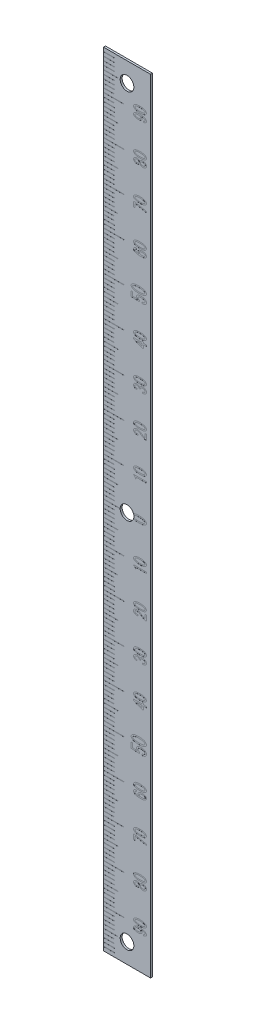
SolidWorks part; units mm, degrees
ref_plane "Front" through (0, 0, 0) normal (0, 0, 1) x (1, 0, 0)
ref_plane "Top" through (0, 0, 0) normal (0, 1, 0) x (1, 0, 0)
ref_plane "Right" through (0, 0, 0) normal (1, 0, 0) x (0, 0, -1)
sketch "Sketch1" plane through (0, 0, 0) normal (0, 0, 1) x (1, 0, 0)
  line L1 (0, 0) -> (0, 200)
  line L2 (0, 0) -> (12, 0)
  line L3 (12, 0) -> (12, 200)
  line L4 (0, 200) -> (12, 200)
  dimension "D1" = 200
  dimension "D2" = 12
extrude "Extrude1" add sketch "Sketch1" along normal blind 0.5
sketch "Sketch2" plane through (0, 0, 0.5) normal (0, 0, 1) x (1, 0, 0)
  line L0 (0, 200) -> (0, 0) construction
  line L1 (0, 0) -> (12, 0) construction
  line L2 (12, 200) -> (0, 200) construction
  circle A0 centre (6, 5) radius 1.75
  circle A1 centre (6, 195) radius 1.75
  circle A4 centre (6, 100) radius 1.75
  dimension "D1" = 6
  dimension "D2" = 6
  dimension "D3" = 5
  dimension "D4" = 5
  dimension "D5" = 3.5
  dimension "D6" = 3.5
  dimension "D8" = 2
extrude "Extrude2" cut sketch "Sketch2" against normal through all
sketch "Sketch3" plane through (0, 0, 0.5) normal (0, 0, 1) x (1, 0, 0)
  line L0 (7.5, 188.25) -> (11, 188.25) construction
  line L1 (7.5, 138.25) -> (11, 138.25) construction
  line L2 (7.5, 138.25) -> (7.5, 141.75) construction
  line L3 (7.5, 141.75) -> (11, 141.75) construction
  line L4 (11, 138.25) -> (11, 141.75) construction
  line L6 (11, 128.25) -> (11, 131.75) construction
  line L7 (11, 118.25) -> (11, 121.75) construction
  line L8 (11, 108.25) -> (11, 111.75) construction
  line L9 (11, 97.2) -> (11, 102.8) construction
  line L10 (11, 88.25) -> (11, 91.75) construction
  line L11 (11, 78.25) -> (11, 81.75) construction
  line L12 (11, 68.25) -> (11, 71.75) construction
  line L13 (11, 58.25) -> (11, 61.75) construction
  line L14 (11, 48) -> (11, 52) construction
  line L15 (11, 38.25) -> (11, 43.5) construction
  line L16 (11, 110) -> (-4.9003, 110) construction
  line L17 (11, 50) -> (-4.9003, 50) construction
  line L18 (11, 28.25) -> (11, 33.5) construction
  line L19 (11, 18.25) -> (11, 23.5) construction
  line L20 (11, 8.25) -> (11, 13.5) construction
  line L21 (11, 100) -> (-4.9003, 100) construction
  line L22 (11, 120) -> (-4.9003, 120) construction
  line L23 (11, 130) -> (-4.9003, 130) construction
  line L24 (11, 140) -> (-4.9003, 140) construction
  line L25 (7.5, 188.25) -> (7.5, 191.75) construction
  line L26 (7.5, 191.75) -> (11, 191.75) construction
  line L27 (11, 188.25) -> (11, 191.75) construction
  line L28 (11, 178.25) -> (11, 181.75) construction
  line L29 (11, 168.25) -> (11, 171.75) construction
  line L30 (11, 158.25) -> (11, 161.75) construction
  line L31 (11, 148) -> (11, 152.8) construction
  line L32 (4.5, 160) -> (-4.9003, 160) construction
  line L33 (4.5, 150) -> (-4.9003, 150) construction
  line L34 (4.5, 170) -> (-4.9003, 170) construction
  line L35 (4.5, 180) -> (-4.9003, 180) construction
  line L36 (4.5, 190) -> (-4.9003, 190) construction
  line L37 (11, 40) -> (-4.9003, 40) construction
  line L38 (11, 30) -> (-4.9003, 30) construction
  line L39 (11, 20) -> (-4.9003, 20) construction
  line L40 (11, 10) -> (-4.9003, 10) construction
  line L41 (12, 0) -> (12, 200) construction
  line L42 (11, 90) -> (-4.9003, 90) construction
  text T0 "40" font "ＭＳ ゴシック" height in points 11
  text T1 "30" font "ＭＳ ゴシック" height in points 11
  text T2 "20" font "ＭＳ ゴシック" height in points 11
  text T3 "10" font "ＭＳ ゴシック" height in points 11
  text T4 " 0 " font "ＭＳ ゴシック" height in points 13
  text T5 "10" font "ＭＳ ゴシック" height in points 11
  text T6 "20" font "ＭＳ ゴシック" height in points 11
  text T7 "30" font "ＭＳ ゴシック" height in points 11
  text T8 "40" font "ＭＳ ゴシック" height in points 11
  text T9 "50" font "ＭＳ ゴシック" height in points 13
  text T10 "60" font "ＭＳ ゴシック" height in points 11
  text T11 "70" font "ＭＳ ゴシック" height in points 11
  text T12 "80" font "ＭＳ ゴシック" height in points 11
  text T13 "90" font "ＭＳ ゴシック" height in points 11
  text T14 "50" font "ＭＳ ゴシック" height in points 13
  text T15 "60" font "ＭＳ ゴシック" height in points 11
  text T16 "70" font "ＭＳ ゴシック" height in points 11
  text T17 "80" font "ＭＳ ゴシック" height in points 11
  text T18 "90" font "ＭＳ ゴシック" height in points 11
  point P19 (11, 100)
  dimension "D1" = 3.5
  dimension "D2" = 1.75
  dimension "D4" = 3.5
  dimension "D8" = 4
  dimension "D9" = 50
  dimension "D10" = 2
  dimension "D11" = 5.6
  dimension "D12" = 1.75
  dimension "D5" = 3.5
  dimension "D13" = 1.75
  dimension "D14" = 1.75
  dimension "D15" = 1
  dimension "D16" = 1.75
  dimension "D17" = 1.75
  dimension "D18" = 1.75
  dimension "D19" = 1.75
  dimension "D20" = 1
  dimension "D21" = 1
  dimension "D23" = 1.75
  dimension "D24" = 2
  dimension "D25" = 1.75
  dimension "D26" = 1.75
  dimension "D27" = 1.75
  dimension "D28" = 1.75
  dimension "D29" = 1
  dimension "D6" = 5
  dimension "D7" = 5
  dimension "D22" = 2
extrude "Extrude3" cut sketch "Sketch3" against normal blind 0.01
sketch "Sketch4" plane through (0, 0, 0.5) normal (0, 0, 1) x (1, 0, 0)
  line L806 (5.8733, 199.8158) -> (5.8733, 186.95) construction
  line L807 (2.7465, 1.05) -> (2.7465, 0.95)
  line L808 (-0.2535, 0.95) -> (2.7465, 0.95)
  line L809 (-0.2535, 1.05) -> (2.7465, 1.05)
  line L810 (-0.2535, 1.05) -> (-0.2535, 0.95)
  line L811 (2.7465, 2.05) -> (2.7465, 1.95)
  line L812 (-0.2535, 1.95) -> (2.7465, 1.95)
  line L813 (-0.2535, 2.05) -> (2.7465, 2.05)
  line L814 (-0.2535, 2.05) -> (-0.2535, 1.95)
  line L815 (2.7465, 3.05) -> (2.7465, 2.95)
  line L816 (-0.2535, 2.95) -> (2.7465, 2.95)
  line L817 (-0.2535, 3.05) -> (2.7465, 3.05)
  line L818 (-0.2535, 3.05) -> (-0.2535, 2.95)
  line L819 (2.7465, 4.05) -> (2.7465, 3.95)
  line L820 (-0.2535, 3.95) -> (2.7465, 3.95)
  line L821 (-0.2535, 4.05) -> (2.7465, 4.05)
  line L822 (-0.2535, 4.05) -> (-0.2535, 3.95)
  line L823 (2.7465, 6.05) -> (2.7465, 5.95)
  line L824 (-0.2535, 5.95) -> (2.7465, 5.95)
  line L825 (-0.2535, 6.05) -> (2.7465, 6.05)
  line L826 (-0.2535, 6.05) -> (-0.2535, 5.95)
  line L827 (2.7465, 7.05) -> (2.7465, 6.95)
  line L828 (-0.2535, 6.95) -> (2.7465, 6.95)
  line L829 (-0.2535, 7.05) -> (2.7465, 7.05)
  line L830 (-0.2535, 7.05) -> (-0.2535, 6.95)
  line L831 (2.7465, 8.05) -> (2.7465, 7.95)
  line L832 (-0.2535, 7.95) -> (2.7465, 7.95)
  line L833 (-0.2535, 8.05) -> (2.7465, 8.05)
  line L834 (2.7465, 9.05) -> (2.7465, 8.95)
  line L835 (-0.2535, 8.95) -> (2.7465, 8.95)
  line L836 (-0.2535, 9.05) -> (-0.2535, 8.95)
  line L837 (-0.2535, 9.05) -> (2.7465, 9.05)
  line L838 (3.7465, 4.95) -> (3.7465, 5.05)
  line L839 (-0.2535, 5.05) -> (3.7465, 5.05)
  line L840 (-0.2535, 4.95) -> (-0.2535, 5.05)
  line L841 (-0.2535, 4.95) -> (3.7465, 4.95)
  line L842 (-0.2535, 8.05) -> (-0.2535, 7.95)
  line L843 (-0.2535, 9.95) -> (-0.2535, 10.05)
  line L844 (5.2465, 9.95) -> (-0.2535, 9.95)
  line L845 (5.2465, 10.05) -> (5.2465, 9.95)
  line L846 (-0.2535, 10.05) -> (5.2465, 10.05)
  line L847 (2.7465, 11.05) -> (2.7465, 10.95)
  line L848 (-0.2535, 10.95) -> (2.7465, 10.95)
  line L849 (-0.2535, 11.05) -> (2.7465, 11.05)
  line L850 (-0.2535, 11.05) -> (-0.2535, 10.95)
  line L851 (2.7465, 12.05) -> (2.7465, 11.95)
  line L852 (-0.2535, 11.95) -> (2.7465, 11.95)
  line L853 (-0.2535, 12.05) -> (2.7465, 12.05)
  line L854 (-0.2535, 12.05) -> (-0.2535, 11.95)
  line L855 (2.7465, 13.05) -> (2.7465, 12.95)
  line L856 (-0.2535, 12.95) -> (2.7465, 12.95)
  line L857 (-0.2535, 13.05) -> (2.7465, 13.05)
  line L858 (-0.2535, 13.05) -> (-0.2535, 12.95)
  line L859 (2.7465, 14.05) -> (2.7465, 13.95)
  line L860 (-0.2535, 13.95) -> (2.7465, 13.95)
  line L861 (-0.2535, 14.05) -> (2.7465, 14.05)
  line L862 (-0.2535, 14.05) -> (-0.2535, 13.95)
  line L863 (2.7465, 16.05) -> (2.7465, 15.95)
  line L864 (-0.2535, 15.95) -> (2.7465, 15.95)
  line L865 (-0.2535, 16.05) -> (2.7465, 16.05)
  line L866 (-0.2535, 16.05) -> (-0.2535, 15.95)
  line L867 (2.7465, 17.05) -> (2.7465, 16.95)
  line L868 (-0.2535, 16.95) -> (2.7465, 16.95)
  line L869 (-0.2535, 17.05) -> (2.7465, 17.05)
  line L870 (-0.2535, 17.05) -> (-0.2535, 16.95)
  line L871 (2.7465, 18.05) -> (2.7465, 17.95)
  line L872 (-0.2535, 17.95) -> (2.7465, 17.95)
  line L873 (-0.2535, 18.05) -> (2.7465, 18.05)
  line L874 (2.7465, 19.05) -> (2.7465, 18.95)
  line L875 (-0.2535, 18.95) -> (2.7465, 18.95)
  line L876 (-0.2535, 19.05) -> (-0.2535, 18.95)
  line L877 (-0.2535, 19.05) -> (2.7465, 19.05)
  line L878 (3.7465, 14.95) -> (3.7465, 15.05)
  line L879 (-0.2535, 15.05) -> (3.7465, 15.05)
  line L880 (-0.2535, 14.95) -> (-0.2535, 15.05)
  line L881 (-0.2535, 14.95) -> (3.7465, 14.95)
  line L882 (-0.2535, 18.05) -> (-0.2535, 17.95)
  line L883 (-0.2535, 19.95) -> (-0.2535, 20.05)
  line L884 (5.2465, 19.95) -> (-0.2535, 19.95)
  line L885 (5.2465, 20.05) -> (5.2465, 19.95)
  line L886 (-0.2535, 20.05) -> (5.2465, 20.05)
  line L887 (2.7465, 21.05) -> (2.7465, 20.95)
  line L888 (-0.2535, 20.95) -> (2.7465, 20.95)
  line L889 (-0.2535, 21.05) -> (2.7465, 21.05)
  line L890 (-0.2535, 21.05) -> (-0.2535, 20.95)
  line L891 (2.7465, 22.05) -> (2.7465, 21.95)
  line L892 (-0.2535, 21.95) -> (2.7465, 21.95)
  line L893 (-0.2535, 22.05) -> (2.7465, 22.05)
  line L894 (-0.2535, 22.05) -> (-0.2535, 21.95)
  line L895 (2.7465, 23.05) -> (2.7465, 22.95)
  line L896 (-0.2535, 22.95) -> (2.7465, 22.95)
  line L897 (-0.2535, 23.05) -> (2.7465, 23.05)
  line L898 (-0.2535, 23.05) -> (-0.2535, 22.95)
  line L899 (2.7465, 24.05) -> (2.7465, 23.95)
  line L900 (-0.2535, 23.95) -> (2.7465, 23.95)
  line L901 (-0.2535, 24.05) -> (2.7465, 24.05)
  line L902 (-0.2535, 24.05) -> (-0.2535, 23.95)
  line L903 (2.7465, 26.05) -> (2.7465, 25.95)
  line L904 (-0.2535, 25.95) -> (2.7465, 25.95)
  line L905 (-0.2535, 26.05) -> (2.7465, 26.05)
  line L906 (-0.2535, 26.05) -> (-0.2535, 25.95)
  line L907 (2.7465, 27.05) -> (2.7465, 26.95)
  line L908 (-0.2535, 26.95) -> (2.7465, 26.95)
  line L909 (-0.2535, 27.05) -> (2.7465, 27.05)
  line L910 (-0.2535, 27.05) -> (-0.2535, 26.95)
  line L911 (2.7465, 28.05) -> (2.7465, 27.95)
  line L912 (-0.2535, 27.95) -> (2.7465, 27.95)
  line L913 (-0.2535, 28.05) -> (2.7465, 28.05)
  line L914 (2.7465, 29.05) -> (2.7465, 28.95)
  line L915 (-0.2535, 28.95) -> (2.7465, 28.95)
  line L916 (-0.2535, 29.05) -> (-0.2535, 28.95)
  line L917 (-0.2535, 29.05) -> (2.7465, 29.05)
  line L918 (3.7465, 24.95) -> (3.7465, 25.05)
  line L919 (-0.2535, 25.05) -> (3.7465, 25.05)
  line L920 (-0.2535, 24.95) -> (-0.2535, 25.05)
  line L921 (-0.2535, 24.95) -> (3.7465, 24.95)
  line L922 (-0.2535, 28.05) -> (-0.2535, 27.95)
  line L923 (-0.2535, 29.95) -> (-0.2535, 30.05)
  line L924 (5.2465, 29.95) -> (-0.2535, 29.95)
  line L925 (5.2465, 30.05) -> (5.2465, 29.95)
  line L926 (-0.2535, 30.05) -> (5.2465, 30.05)
  line L927 (2.7465, 31.05) -> (2.7465, 30.95)
  line L928 (-0.2535, 30.95) -> (2.7465, 30.95)
  line L929 (-0.2535, 31.05) -> (2.7465, 31.05)
  line L930 (-0.2535, 31.05) -> (-0.2535, 30.95)
  line L931 (2.7465, 32.05) -> (2.7465, 31.95)
  line L932 (-0.2535, 31.95) -> (2.7465, 31.95)
  line L933 (-0.2535, 32.05) -> (2.7465, 32.05)
  line L934 (-0.2535, 32.05) -> (-0.2535, 31.95)
  line L935 (2.7465, 33.05) -> (2.7465, 32.95)
  line L936 (-0.2535, 32.95) -> (2.7465, 32.95)
  line L937 (-0.2535, 33.05) -> (2.7465, 33.05)
  line L938 (-0.2535, 33.05) -> (-0.2535, 32.95)
  line L939 (2.7465, 34.05) -> (2.7465, 33.95)
  line L940 (-0.2535, 33.95) -> (2.7465, 33.95)
  line L941 (-0.2535, 34.05) -> (2.7465, 34.05)
  line L942 (-0.2535, 34.05) -> (-0.2535, 33.95)
  line L943 (2.7465, 36.05) -> (2.7465, 35.95)
  line L944 (-0.2535, 35.95) -> (2.7465, 35.95)
  line L945 (-0.2535, 36.05) -> (2.7465, 36.05)
  line L946 (-0.2535, 36.05) -> (-0.2535, 35.95)
  line L947 (2.7465, 37.05) -> (2.7465, 36.95)
  line L948 (-0.2535, 36.95) -> (2.7465, 36.95)
  line L949 (-0.2535, 37.05) -> (2.7465, 37.05)
  line L950 (-0.2535, 37.05) -> (-0.2535, 36.95)
  line L951 (2.7465, 38.05) -> (2.7465, 37.95)
  line L952 (-0.2535, 37.95) -> (2.7465, 37.95)
  line L953 (-0.2535, 38.05) -> (2.7465, 38.05)
  line L954 (2.7465, 39.05) -> (2.7465, 38.95)
  line L955 (-0.2535, 38.95) -> (2.7465, 38.95)
  line L956 (-0.2535, 39.05) -> (-0.2535, 38.95)
  line L957 (-0.2535, 39.05) -> (2.7465, 39.05)
  line L958 (3.7465, 34.95) -> (3.7465, 35.05)
  line L959 (-0.2535, 35.05) -> (3.7465, 35.05)
  line L960 (-0.2535, 34.95) -> (-0.2535, 35.05)
  line L961 (-0.2535, 34.95) -> (3.7465, 34.95)
  line L962 (-0.2535, 38.05) -> (-0.2535, 37.95)
  line L963 (-0.2535, 39.95) -> (-0.2535, 40.05)
  line L964 (5.2465, 39.95) -> (-0.2535, 39.95)
  line L965 (5.2465, 40.05) -> (5.2465, 39.95)
  line L966 (-0.2535, 40.05) -> (5.2465, 40.05)
  line L967 (2.7465, 41.05) -> (2.7465, 40.95)
  line L968 (-0.2535, 40.95) -> (2.7465, 40.95)
  line L969 (-0.2535, 41.05) -> (2.7465, 41.05)
  line L970 (-0.2535, 41.05) -> (-0.2535, 40.95)
  line L971 (2.7465, 42.05) -> (2.7465, 41.95)
  line L972 (-0.2535, 41.95) -> (2.7465, 41.95)
  line L973 (-0.2535, 42.05) -> (2.7465, 42.05)
  line L974 (-0.2535, 42.05) -> (-0.2535, 41.95)
  line L975 (2.7465, 43.05) -> (2.7465, 42.95)
  line L976 (-0.2535, 42.95) -> (2.7465, 42.95)
  line L977 (-0.2535, 43.05) -> (2.7465, 43.05)
  line L978 (-0.2535, 43.05) -> (-0.2535, 42.95)
  line L979 (2.7465, 44.05) -> (2.7465, 43.95)
  line L980 (-0.2535, 43.95) -> (2.7465, 43.95)
  line L981 (-0.2535, 44.05) -> (2.7465, 44.05)
  line L982 (-0.2535, 44.05) -> (-0.2535, 43.95)
  line L983 (2.7465, 46.05) -> (2.7465, 45.95)
  line L984 (-0.2535, 45.95) -> (2.7465, 45.95)
  line L985 (-0.2535, 46.05) -> (2.7465, 46.05)
  line L986 (-0.2535, 46.05) -> (-0.2535, 45.95)
  line L987 (2.7465, 47.05) -> (2.7465, 46.95)
  line L988 (-0.2535, 46.95) -> (2.7465, 46.95)
  line L989 (-0.2535, 47.05) -> (2.7465, 47.05)
  line L990 (-0.2535, 47.05) -> (-0.2535, 46.95)
  line L991 (2.7465, 48.05) -> (2.7465, 47.95)
  line L992 (-0.2535, 47.95) -> (2.7465, 47.95)
  line L993 (-0.2535, 48.05) -> (2.7465, 48.05)
  line L994 (2.7465, 49.05) -> (2.7465, 48.95)
  line L995 (-0.2535, 48.95) -> (2.7465, 48.95)
  line L996 (-0.2535, 49.05) -> (-0.2535, 48.95)
  line L997 (-0.2535, 49.05) -> (2.7465, 49.05)
  line L998 (3.7465, 44.95) -> (3.7465, 45.05)
  line L999 (-0.2535, 45.05) -> (3.7465, 45.05)
  line L1000 (-0.2535, 44.95) -> (-0.2535, 45.05)
  line L1001 (-0.2535, 44.95) -> (3.7465, 44.95)
  line L1002 (-0.2535, 48.05) -> (-0.2535, 47.95)
  line L1003 (-0.2535, 49.95) -> (-0.2535, 50.05)
  line L1004 (5.2465, 49.95) -> (-0.2535, 49.95)
  line L1005 (5.2465, 50.05) -> (5.2465, 49.95)
  line L1006 (-0.2535, 50.05) -> (5.2465, 50.05)
  line L1007 (2.7465, 51.05) -> (2.7465, 50.95)
  line L1008 (-0.2535, 50.95) -> (2.7465, 50.95)
  line L1009 (-0.2535, 51.05) -> (2.7465, 51.05)
  line L1010 (-0.2535, 51.05) -> (-0.2535, 50.95)
  line L1011 (2.7465, 52.05) -> (2.7465, 51.95)
  line L1012 (-0.2535, 51.95) -> (2.7465, 51.95)
  line L1013 (-0.2535, 52.05) -> (2.7465, 52.05)
  line L1014 (-0.2535, 52.05) -> (-0.2535, 51.95)
  line L1015 (2.7465, 53.05) -> (2.7465, 52.95)
  line L1016 (-0.2535, 52.95) -> (2.7465, 52.95)
  line L1017 (-0.2535, 53.05) -> (2.7465, 53.05)
  line L1018 (-0.2535, 53.05) -> (-0.2535, 52.95)
  line L1019 (2.7465, 54.05) -> (2.7465, 53.95)
  line L1020 (-0.2535, 53.95) -> (2.7465, 53.95)
  line L1021 (-0.2535, 54.05) -> (2.7465, 54.05)
  line L1022 (-0.2535, 54.05) -> (-0.2535, 53.95)
  line L1023 (2.7465, 56.05) -> (2.7465, 55.95)
  line L1024 (-0.2535, 55.95) -> (2.7465, 55.95)
  line L1025 (-0.2535, 56.05) -> (2.7465, 56.05)
  line L1026 (-0.2535, 56.05) -> (-0.2535, 55.95)
  line L1027 (2.7465, 57.05) -> (2.7465, 56.95)
  line L1028 (-0.2535, 56.95) -> (2.7465, 56.95)
  line L1029 (-0.2535, 57.05) -> (2.7465, 57.05)
  line L1030 (-0.2535, 57.05) -> (-0.2535, 56.95)
  line L1031 (2.7465, 58.05) -> (2.7465, 57.95)
  line L1032 (-0.2535, 57.95) -> (2.7465, 57.95)
  line L1033 (-0.2535, 58.05) -> (2.7465, 58.05)
  line L1034 (2.7465, 59.05) -> (2.7465, 58.95)
  line L1035 (-0.2535, 58.95) -> (2.7465, 58.95)
  line L1036 (-0.2535, 59.05) -> (-0.2535, 58.95)
  line L1037 (-0.2535, 59.05) -> (2.7465, 59.05)
  line L1038 (3.7465, 54.95) -> (3.7465, 55.05)
  line L1039 (-0.2535, 55.05) -> (3.7465, 55.05)
  line L1040 (-0.2535, 54.95) -> (-0.2535, 55.05)
  line L1041 (-0.2535, 54.95) -> (3.7465, 54.95)
  line L1042 (-0.2535, 58.05) -> (-0.2535, 57.95)
  line L1043 (-0.2535, 59.95) -> (-0.2535, 60.05)
  line L1044 (5.2465, 59.95) -> (-0.2535, 59.95)
  line L1045 (5.2465, 60.05) -> (5.2465, 59.95)
  line L1046 (-0.2535, 60.05) -> (5.2465, 60.05)
  line L1047 (2.7465, 61.05) -> (2.7465, 60.95)
  line L1048 (-0.2535, 60.95) -> (2.7465, 60.95)
  line L1049 (-0.2535, 61.05) -> (2.7465, 61.05)
  line L1050 (-0.2535, 61.05) -> (-0.2535, 60.95)
  line L1051 (2.7465, 62.05) -> (2.7465, 61.95)
  line L1052 (-0.2535, 61.95) -> (2.7465, 61.95)
  line L1053 (-0.2535, 62.05) -> (2.7465, 62.05)
  line L1054 (-0.2535, 62.05) -> (-0.2535, 61.95)
  line L1055 (2.7465, 63.05) -> (2.7465, 62.95)
  line L1056 (-0.2535, 62.95) -> (2.7465, 62.95)
  line L1057 (-0.2535, 63.05) -> (2.7465, 63.05)
  line L1058 (-0.2535, 63.05) -> (-0.2535, 62.95)
  line L1059 (2.7465, 64.05) -> (2.7465, 63.95)
  line L1060 (-0.2535, 63.95) -> (2.7465, 63.95)
  line L1061 (-0.2535, 64.05) -> (2.7465, 64.05)
  line L1062 (-0.2535, 64.05) -> (-0.2535, 63.95)
  line L1063 (2.7465, 66.05) -> (2.7465, 65.95)
  line L1064 (-0.2535, 65.95) -> (2.7465, 65.95)
  line L1065 (-0.2535, 66.05) -> (2.7465, 66.05)
  line L1066 (-0.2535, 66.05) -> (-0.2535, 65.95)
  line L1067 (2.7465, 67.05) -> (2.7465, 66.95)
  line L1068 (-0.2535, 66.95) -> (2.7465, 66.95)
  line L1069 (-0.2535, 67.05) -> (2.7465, 67.05)
  line L1070 (-0.2535, 67.05) -> (-0.2535, 66.95)
  line L1071 (2.7465, 68.05) -> (2.7465, 67.95)
  line L1072 (-0.2535, 67.95) -> (2.7465, 67.95)
  line L1073 (-0.2535, 68.05) -> (2.7465, 68.05)
  line L1074 (2.7465, 69.05) -> (2.7465, 68.95)
  line L1075 (-0.2535, 68.95) -> (2.7465, 68.95)
  line L1076 (-0.2535, 69.05) -> (-0.2535, 68.95)
  line L1077 (-0.2535, 69.05) -> (2.7465, 69.05)
  line L1078 (3.7465, 64.95) -> (3.7465, 65.05)
  line L1079 (-0.2535, 65.05) -> (3.7465, 65.05)
  line L1080 (-0.2535, 64.95) -> (-0.2535, 65.05)
  line L1081 (-0.2535, 64.95) -> (3.7465, 64.95)
  line L1082 (-0.2535, 68.05) -> (-0.2535, 67.95)
  line L1083 (-0.2535, 69.95) -> (-0.2535, 70.05)
  line L1084 (5.2465, 69.95) -> (-0.2535, 69.95)
  line L1085 (5.2465, 70.05) -> (5.2465, 69.95)
  line L1086 (-0.2535, 70.05) -> (5.2465, 70.05)
  line L1087 (2.7465, 71.05) -> (2.7465, 70.95)
  line L1088 (-0.2535, 70.95) -> (2.7465, 70.95)
  line L1089 (-0.2535, 71.05) -> (2.7465, 71.05)
  line L1090 (-0.2535, 71.05) -> (-0.2535, 70.95)
  line L1091 (2.7465, 72.05) -> (2.7465, 71.95)
  line L1092 (-0.2535, 71.95) -> (2.7465, 71.95)
  line L1093 (-0.2535, 72.05) -> (2.7465, 72.05)
  line L1094 (-0.2535, 72.05) -> (-0.2535, 71.95)
  line L1095 (2.7465, 73.05) -> (2.7465, 72.95)
  line L1096 (-0.2535, 72.95) -> (2.7465, 72.95)
  line L1097 (-0.2535, 73.05) -> (2.7465, 73.05)
  line L1098 (-0.2535, 73.05) -> (-0.2535, 72.95)
  line L1099 (2.7465, 74.05) -> (2.7465, 73.95)
  line L1100 (-0.2535, 73.95) -> (2.7465, 73.95)
  line L1101 (-0.2535, 74.05) -> (2.7465, 74.05)
  line L1102 (-0.2535, 74.05) -> (-0.2535, 73.95)
  line L1103 (2.7465, 76.05) -> (2.7465, 75.95)
  line L1104 (-0.2535, 75.95) -> (2.7465, 75.95)
  line L1105 (-0.2535, 76.05) -> (2.7465, 76.05)
  line L1106 (-0.2535, 76.05) -> (-0.2535, 75.95)
  line L1107 (2.7465, 77.05) -> (2.7465, 76.95)
  line L1108 (-0.2535, 76.95) -> (2.7465, 76.95)
  line L1109 (-0.2535, 77.05) -> (2.7465, 77.05)
  line L1110 (-0.2535, 77.05) -> (-0.2535, 76.95)
  line L1111 (2.7465, 78.05) -> (2.7465, 77.95)
  line L1112 (-0.2535, 77.95) -> (2.7465, 77.95)
  line L1113 (-0.2535, 78.05) -> (2.7465, 78.05)
  line L1114 (2.7465, 79.05) -> (2.7465, 78.95)
  line L1115 (-0.2535, 78.95) -> (2.7465, 78.95)
  line L1116 (-0.2535, 79.05) -> (-0.2535, 78.95)
  line L1117 (-0.2535, 79.05) -> (2.7465, 79.05)
  line L1118 (3.7465, 74.95) -> (3.7465, 75.05)
  line L1119 (-0.2535, 75.05) -> (3.7465, 75.05)
  line L1120 (-0.2535, 74.95) -> (-0.2535, 75.05)
  line L1121 (-0.2535, 74.95) -> (3.7465, 74.95)
  line L1122 (-0.2535, 78.05) -> (-0.2535, 77.95)
  line L1123 (-0.2535, 79.95) -> (-0.2535, 80.05)
  line L1124 (5.2465, 79.95) -> (-0.2535, 79.95)
  line L1125 (5.2465, 80.05) -> (5.2465, 79.95)
  line L1126 (-0.2535, 80.05) -> (5.2465, 80.05)
  line L1127 (2.7465, 81.05) -> (2.7465, 80.95)
  line L1128 (-0.2535, 80.95) -> (2.7465, 80.95)
  line L1129 (-0.2535, 81.05) -> (2.7465, 81.05)
  line L1130 (-0.2535, 81.05) -> (-0.2535, 80.95)
  line L1131 (2.7465, 82.05) -> (2.7465, 81.95)
  line L1132 (-0.2535, 81.95) -> (2.7465, 81.95)
  line L1133 (-0.2535, 82.05) -> (2.7465, 82.05)
  line L1134 (-0.2535, 82.05) -> (-0.2535, 81.95)
  line L1135 (2.7465, 83.05) -> (2.7465, 82.95)
  line L1136 (-0.2535, 82.95) -> (2.7465, 82.95)
  line L1137 (-0.2535, 83.05) -> (2.7465, 83.05)
  line L1138 (-0.2535, 83.05) -> (-0.2535, 82.95)
  line L1139 (2.7465, 84.05) -> (2.7465, 83.95)
  line L1140 (-0.2535, 83.95) -> (2.7465, 83.95)
  line L1141 (-0.2535, 84.05) -> (2.7465, 84.05)
  line L1142 (-0.2535, 84.05) -> (-0.2535, 83.95)
  line L1143 (2.7465, 86.05) -> (2.7465, 85.95)
  line L1144 (-0.2535, 85.95) -> (2.7465, 85.95)
  line L1145 (-0.2535, 86.05) -> (2.7465, 86.05)
  line L1146 (-0.2535, 86.05) -> (-0.2535, 85.95)
  line L1147 (2.7465, 87.05) -> (2.7465, 86.95)
  line L1148 (-0.2535, 86.95) -> (2.7465, 86.95)
  line L1149 (-0.2535, 87.05) -> (2.7465, 87.05)
  line L1150 (-0.2535, 87.05) -> (-0.2535, 86.95)
  line L1151 (2.7465, 88.05) -> (2.7465, 87.95)
  line L1152 (-0.2535, 87.95) -> (2.7465, 87.95)
  line L1153 (-0.2535, 88.05) -> (2.7465, 88.05)
  line L1154 (2.7465, 89.05) -> (2.7465, 88.95)
  line L1155 (-0.2535, 88.95) -> (2.7465, 88.95)
  line L1156 (-0.2535, 89.05) -> (-0.2535, 88.95)
  line L1157 (-0.2535, 89.05) -> (2.7465, 89.05)
  line L1158 (3.7465, 84.95) -> (3.7465, 85.05)
  line L1159 (-0.2535, 85.05) -> (3.7465, 85.05)
  line L1160 (-0.2535, 84.95) -> (-0.2535, 85.05)
  line L1161 (-0.2535, 84.95) -> (3.7465, 84.95)
  line L1162 (-0.2535, 88.05) -> (-0.2535, 87.95)
  line L1163 (-0.2535, 89.95) -> (-0.2535, 90.05)
  line L1164 (5.2465, 89.95) -> (-0.2535, 89.95)
  line L1165 (5.2465, 90.05) -> (5.2465, 89.95)
  line L1166 (-0.2535, 90.05) -> (5.2465, 90.05)
  line L1167 (2.7465, 91.05) -> (2.7465, 90.95)
  line L1168 (-0.2535, 90.95) -> (2.7465, 90.95)
  line L1169 (-0.2535, 91.05) -> (2.7465, 91.05)
  line L1170 (-0.2535, 91.05) -> (-0.2535, 90.95)
  line L1171 (2.7465, 92.05) -> (2.7465, 91.95)
  line L1172 (-0.2535, 91.95) -> (2.7465, 91.95)
  line L1173 (-0.2535, 92.05) -> (2.7465, 92.05)
  line L1174 (-0.2535, 92.05) -> (-0.2535, 91.95)
  line L1175 (2.7465, 93.05) -> (2.7465, 92.95)
  line L1176 (-0.2535, 92.95) -> (2.7465, 92.95)
  line L1177 (-0.2535, 93.05) -> (2.7465, 93.05)
  line L1178 (-0.2535, 93.05) -> (-0.2535, 92.95)
  line L1179 (2.7465, 94.05) -> (2.7465, 93.95)
  line L1180 (-0.2535, 93.95) -> (2.7465, 93.95)
  line L1181 (-0.2535, 94.05) -> (2.7465, 94.05)
  line L1182 (-0.2535, 94.05) -> (-0.2535, 93.95)
  line L1183 (2.7465, 96.05) -> (2.7465, 95.95)
  line L1184 (-0.2535, 95.95) -> (2.7465, 95.95)
  line L1185 (-0.2535, 96.05) -> (2.7465, 96.05)
  line L1186 (-0.2535, 96.05) -> (-0.2535, 95.95)
  line L1187 (2.7465, 97.05) -> (2.7465, 96.95)
  line L1188 (-0.2535, 96.95) -> (2.7465, 96.95)
  line L1189 (-0.2535, 97.05) -> (2.7465, 97.05)
  line L1190 (-0.2535, 97.05) -> (-0.2535, 96.95)
  line L1191 (2.7465, 98.05) -> (2.7465, 97.95)
  line L1192 (-0.2535, 97.95) -> (2.7465, 97.95)
  line L1193 (-0.2535, 98.05) -> (2.7465, 98.05)
  line L1194 (2.7465, 99.05) -> (2.7465, 98.95)
  line L1195 (-0.2535, 98.95) -> (2.7465, 98.95)
  line L1196 (-0.2535, 99.05) -> (-0.2535, 98.95)
  line L1197 (-0.2535, 99.05) -> (2.7465, 99.05)
  line L1198 (3.7465, 94.95) -> (3.7465, 95.05)
  line L1199 (-0.2535, 95.05) -> (3.7465, 95.05)
  line L1200 (-0.2535, 94.95) -> (-0.2535, 95.05)
  line L1201 (-0.2535, 94.95) -> (3.7465, 94.95)
  line L1202 (-0.2535, 98.05) -> (-0.2535, 97.95)
  line L1203 (-0.2535, 99.95) -> (-0.2535, 100.05)
  line L1204 (5.2465, 99.95) -> (-0.2535, 99.95)
  line L1205 (5.2465, 100.05) -> (5.2465, 99.95)
  line L1206 (-0.2535, 100.05) -> (5.2465, 100.05)
  line L1207 (2.7465, 101.05) -> (2.7465, 100.95)
  line L1208 (-0.2535, 100.95) -> (2.7465, 100.95)
  line L1209 (-0.2535, 101.05) -> (2.7465, 101.05)
  line L1210 (-0.2535, 101.05) -> (-0.2535, 100.95)
  line L1211 (2.7465, 102.05) -> (2.7465, 101.95)
  line L1212 (-0.2535, 101.95) -> (2.7465, 101.95)
  line L1213 (-0.2535, 102.05) -> (2.7465, 102.05)
  line L1214 (-0.2535, 102.05) -> (-0.2535, 101.95)
  line L1215 (2.7465, 103.05) -> (2.7465, 102.95)
  line L1216 (-0.2535, 102.95) -> (2.7465, 102.95)
  line L1217 (-0.2535, 103.05) -> (2.7465, 103.05)
  line L1218 (-0.2535, 103.05) -> (-0.2535, 102.95)
  line L1219 (2.7465, 104.05) -> (2.7465, 103.95)
  line L1220 (-0.2535, 103.95) -> (2.7465, 103.95)
  line L1221 (-0.2535, 104.05) -> (2.7465, 104.05)
  line L1222 (-0.2535, 104.05) -> (-0.2535, 103.95)
  line L1223 (2.7465, 106.05) -> (2.7465, 105.95)
  line L1224 (-0.2535, 105.95) -> (2.7465, 105.95)
  line L1225 (-0.2535, 106.05) -> (2.7465, 106.05)
  line L1226 (-0.2535, 106.05) -> (-0.2535, 105.95)
  line L1227 (2.7465, 107.05) -> (2.7465, 106.95)
  line L1228 (-0.2535, 106.95) -> (2.7465, 106.95)
  line L1229 (-0.2535, 107.05) -> (2.7465, 107.05)
  line L1230 (-0.2535, 107.05) -> (-0.2535, 106.95)
  line L1231 (2.7465, 108.05) -> (2.7465, 107.95)
  line L1232 (-0.2535, 107.95) -> (2.7465, 107.95)
  line L1233 (-0.2535, 108.05) -> (2.7465, 108.05)
  line L1234 (2.7465, 109.05) -> (2.7465, 108.95)
  line L1235 (-0.2535, 108.95) -> (2.7465, 108.95)
  line L1236 (-0.2535, 109.05) -> (-0.2535, 108.95)
  line L1237 (-0.2535, 109.05) -> (2.7465, 109.05)
  line L1238 (3.7465, 104.95) -> (3.7465, 105.05)
  line L1239 (-0.2535, 105.05) -> (3.7465, 105.05)
  line L1240 (-0.2535, 104.95) -> (-0.2535, 105.05)
  line L1241 (-0.2535, 104.95) -> (3.7465, 104.95)
  line L1242 (-0.2535, 108.05) -> (-0.2535, 107.95)
  line L1243 (-0.2535, 109.95) -> (-0.2535, 110.05)
  line L1244 (5.2465, 109.95) -> (-0.2535, 109.95)
  line L1245 (5.2465, 110.05) -> (5.2465, 109.95)
  line L1246 (-0.2535, 110.05) -> (5.2465, 110.05)
  line L1247 (2.7465, 111.05) -> (2.7465, 110.95)
  line L1248 (-0.2535, 110.95) -> (2.7465, 110.95)
  line L1249 (-0.2535, 111.05) -> (2.7465, 111.05)
  line L1250 (-0.2535, 111.05) -> (-0.2535, 110.95)
  line L1251 (2.7465, 112.05) -> (2.7465, 111.95)
  line L1252 (-0.2535, 111.95) -> (2.7465, 111.95)
  line L1253 (-0.2535, 112.05) -> (2.7465, 112.05)
  line L1254 (-0.2535, 112.05) -> (-0.2535, 111.95)
  line L1255 (2.7465, 113.05) -> (2.7465, 112.95)
  line L1256 (-0.2535, 112.95) -> (2.7465, 112.95)
  line L1257 (-0.2535, 113.05) -> (2.7465, 113.05)
  line L1258 (-0.2535, 113.05) -> (-0.2535, 112.95)
  line L1259 (2.7465, 114.05) -> (2.7465, 113.95)
  line L1260 (-0.2535, 113.95) -> (2.7465, 113.95)
  line L1261 (-0.2535, 114.05) -> (2.7465, 114.05)
  line L1262 (-0.2535, 114.05) -> (-0.2535, 113.95)
  line L1263 (2.7465, 116.05) -> (2.7465, 115.95)
  line L1264 (-0.2535, 115.95) -> (2.7465, 115.95)
  line L1265 (-0.2535, 116.05) -> (2.7465, 116.05)
  line L1266 (-0.2535, 116.05) -> (-0.2535, 115.95)
  line L1267 (2.7465, 117.05) -> (2.7465, 116.95)
  line L1268 (-0.2535, 116.95) -> (2.7465, 116.95)
  line L1269 (-0.2535, 117.05) -> (2.7465, 117.05)
  line L1270 (-0.2535, 117.05) -> (-0.2535, 116.95)
  line L1271 (2.7465, 118.05) -> (2.7465, 117.95)
  line L1272 (-0.2535, 117.95) -> (2.7465, 117.95)
  line L1273 (-0.2535, 118.05) -> (2.7465, 118.05)
  line L1274 (2.7465, 119.05) -> (2.7465, 118.95)
  line L1275 (-0.2535, 118.95) -> (2.7465, 118.95)
  line L1276 (-0.2535, 119.05) -> (-0.2535, 118.95)
  line L1277 (-0.2535, 119.05) -> (2.7465, 119.05)
  line L1278 (3.7465, 114.95) -> (3.7465, 115.05)
  line L1279 (-0.2535, 115.05) -> (3.7465, 115.05)
  line L1280 (-0.2535, 114.95) -> (-0.2535, 115.05)
  line L1281 (-0.2535, 114.95) -> (3.7465, 114.95)
  line L1282 (-0.2535, 118.05) -> (-0.2535, 117.95)
  line L1283 (-0.2535, 119.95) -> (-0.2535, 120.05)
  line L1284 (5.2465, 119.95) -> (-0.2535, 119.95)
  line L1285 (5.2465, 120.05) -> (5.2465, 119.95)
  line L1286 (-0.2535, 120.05) -> (5.2465, 120.05)
  line L1287 (2.7465, 121.05) -> (2.7465, 120.95)
  line L1288 (-0.2535, 120.95) -> (2.7465, 120.95)
  line L1289 (-0.2535, 121.05) -> (2.7465, 121.05)
  line L1290 (-0.2535, 121.05) -> (-0.2535, 120.95)
  line L1291 (2.7465, 122.05) -> (2.7465, 121.95)
  line L1292 (-0.2535, 121.95) -> (2.7465, 121.95)
  line L1293 (-0.2535, 122.05) -> (2.7465, 122.05)
  line L1294 (-0.2535, 122.05) -> (-0.2535, 121.95)
  line L1295 (2.7465, 123.05) -> (2.7465, 122.95)
  line L1296 (-0.2535, 122.95) -> (2.7465, 122.95)
  line L1297 (-0.2535, 123.05) -> (2.7465, 123.05)
  line L1298 (-0.2535, 123.05) -> (-0.2535, 122.95)
  line L1299 (2.7465, 124.05) -> (2.7465, 123.95)
  line L1300 (-0.2535, 123.95) -> (2.7465, 123.95)
  line L1301 (-0.2535, 124.05) -> (2.7465, 124.05)
  line L1302 (-0.2535, 124.05) -> (-0.2535, 123.95)
  line L1303 (2.7465, 126.05) -> (2.7465, 125.95)
  line L1304 (-0.2535, 125.95) -> (2.7465, 125.95)
  line L1305 (-0.2535, 126.05) -> (2.7465, 126.05)
  line L1306 (-0.2535, 126.05) -> (-0.2535, 125.95)
  line L1307 (2.7465, 127.05) -> (2.7465, 126.95)
  line L1308 (-0.2535, 126.95) -> (2.7465, 126.95)
  line L1309 (-0.2535, 127.05) -> (2.7465, 127.05)
  line L1310 (-0.2535, 127.05) -> (-0.2535, 126.95)
  line L1311 (2.7465, 128.05) -> (2.7465, 127.95)
  line L1312 (-0.2535, 127.95) -> (2.7465, 127.95)
  line L1313 (-0.2535, 128.05) -> (2.7465, 128.05)
  line L1314 (2.7465, 129.05) -> (2.7465, 128.95)
  line L1315 (-0.2535, 128.95) -> (2.7465, 128.95)
  line L1316 (-0.2535, 129.05) -> (-0.2535, 128.95)
  line L1317 (-0.2535, 129.05) -> (2.7465, 129.05)
  line L1318 (3.7465, 124.95) -> (3.7465, 125.05)
  line L1319 (-0.2535, 125.05) -> (3.7465, 125.05)
  line L1320 (-0.2535, 124.95) -> (-0.2535, 125.05)
  line L1321 (-0.2535, 124.95) -> (3.7465, 124.95)
  line L1322 (-0.2535, 128.05) -> (-0.2535, 127.95)
  line L1323 (-0.2535, 129.95) -> (-0.2535, 130.05)
  line L1324 (5.2465, 129.95) -> (-0.2535, 129.95)
  line L1325 (5.2465, 130.05) -> (5.2465, 129.95)
  line L1326 (-0.2535, 130.05) -> (5.2465, 130.05)
  line L1327 (2.7465, 131.05) -> (2.7465, 130.95)
  line L1328 (-0.2535, 130.95) -> (2.7465, 130.95)
  line L1329 (-0.2535, 131.05) -> (2.7465, 131.05)
  line L1330 (-0.2535, 131.05) -> (-0.2535, 130.95)
  line L1331 (2.7465, 132.05) -> (2.7465, 131.95)
  line L1332 (-0.2535, 131.95) -> (2.7465, 131.95)
  line L1333 (-0.2535, 132.05) -> (2.7465, 132.05)
  line L1334 (-0.2535, 132.05) -> (-0.2535, 131.95)
  line L1335 (2.7465, 133.05) -> (2.7465, 132.95)
  line L1336 (-0.2535, 132.95) -> (2.7465, 132.95)
  line L1337 (-0.2535, 133.05) -> (2.7465, 133.05)
  line L1338 (-0.2535, 133.05) -> (-0.2535, 132.95)
  line L1339 (2.7465, 134.05) -> (2.7465, 133.95)
  line L1340 (-0.2535, 133.95) -> (2.7465, 133.95)
  line L1341 (-0.2535, 134.05) -> (2.7465, 134.05)
  line L1342 (-0.2535, 134.05) -> (-0.2535, 133.95)
  line L1343 (2.7465, 136.05) -> (2.7465, 135.95)
  line L1344 (-0.2535, 135.95) -> (2.7465, 135.95)
  line L1345 (-0.2535, 136.05) -> (2.7465, 136.05)
  line L1346 (-0.2535, 136.05) -> (-0.2535, 135.95)
  line L1347 (2.7465, 137.05) -> (2.7465, 136.95)
  line L1348 (-0.2535, 136.95) -> (2.7465, 136.95)
  line L1349 (-0.2535, 137.05) -> (2.7465, 137.05)
  line L1350 (-0.2535, 137.05) -> (-0.2535, 136.95)
  line L1351 (2.7465, 138.05) -> (2.7465, 137.95)
  line L1352 (-0.2535, 137.95) -> (2.7465, 137.95)
  line L1353 (-0.2535, 138.05) -> (2.7465, 138.05)
  line L1354 (2.7465, 139.05) -> (2.7465, 138.95)
  line L1355 (-0.2535, 138.95) -> (2.7465, 138.95)
  line L1356 (-0.2535, 139.05) -> (-0.2535, 138.95)
  line L1357 (-0.2535, 139.05) -> (2.7465, 139.05)
  line L1358 (3.7465, 134.95) -> (3.7465, 135.05)
  line L1359 (-0.2535, 135.05) -> (3.7465, 135.05)
  line L1360 (-0.2535, 134.95) -> (-0.2535, 135.05)
  line L1361 (-0.2535, 134.95) -> (3.7465, 134.95)
  line L1362 (-0.2535, 138.05) -> (-0.2535, 137.95)
  line L1363 (-0.2535, 139.95) -> (-0.2535, 140.05)
  line L1364 (5.2465, 139.95) -> (-0.2535, 139.95)
  line L1365 (5.2465, 140.05) -> (5.2465, 139.95)
  line L1366 (-0.2535, 140.05) -> (5.2465, 140.05)
  line L1367 (2.7465, 141.05) -> (2.7465, 140.95)
  line L1368 (-0.2535, 140.95) -> (2.7465, 140.95)
  line L1369 (-0.2535, 141.05) -> (2.7465, 141.05)
  line L1370 (-0.2535, 141.05) -> (-0.2535, 140.95)
  line L1371 (2.7465, 142.05) -> (2.7465, 141.95)
  line L1372 (-0.2535, 141.95) -> (2.7465, 141.95)
  line L1373 (-0.2535, 142.05) -> (2.7465, 142.05)
  line L1374 (-0.2535, 142.05) -> (-0.2535, 141.95)
  line L1375 (2.7465, 143.05) -> (2.7465, 142.95)
  line L1376 (-0.2535, 142.95) -> (2.7465, 142.95)
  line L1377 (-0.2535, 143.05) -> (2.7465, 143.05)
  line L1378 (-0.2535, 143.05) -> (-0.2535, 142.95)
  line L1379 (2.7465, 144.05) -> (2.7465, 143.95)
  line L1380 (-0.2535, 143.95) -> (2.7465, 143.95)
  line L1381 (-0.2535, 144.05) -> (2.7465, 144.05)
  line L1382 (-0.2535, 144.05) -> (-0.2535, 143.95)
  line L1383 (2.7465, 146.05) -> (2.7465, 145.95)
  line L1384 (-0.2535, 145.95) -> (2.7465, 145.95)
  line L1385 (-0.2535, 146.05) -> (2.7465, 146.05)
  line L1386 (-0.2535, 146.05) -> (-0.2535, 145.95)
  line L1387 (2.7465, 147.05) -> (2.7465, 146.95)
  line L1388 (-0.2535, 146.95) -> (2.7465, 146.95)
  line L1389 (-0.2535, 147.05) -> (2.7465, 147.05)
  line L1390 (-0.2535, 147.05) -> (-0.2535, 146.95)
  line L1391 (2.7465, 148.05) -> (2.7465, 147.95)
  line L1392 (-0.2535, 147.95) -> (2.7465, 147.95)
  line L1393 (-0.2535, 148.05) -> (2.7465, 148.05)
  line L1394 (2.7465, 149.05) -> (2.7465, 148.95)
  line L1395 (-0.2535, 148.95) -> (2.7465, 148.95)
  line L1396 (-0.2535, 149.05) -> (-0.2535, 148.95)
  line L1397 (-0.2535, 149.05) -> (2.7465, 149.05)
  line L1398 (3.7465, 144.95) -> (3.7465, 145.05)
  line L1399 (-0.2535, 145.05) -> (3.7465, 145.05)
  line L1400 (-0.2535, 144.95) -> (-0.2535, 145.05)
  line L1401 (-0.2535, 144.95) -> (3.7465, 144.95)
  line L1402 (-0.2535, 148.05) -> (-0.2535, 147.95)
  line L1403 (2.7465, 151.05) -> (2.7465, 150.95)
  line L1404 (-0.2535, 150.95) -> (2.7465, 150.95)
  line L1405 (-0.2535, 151.05) -> (2.7465, 151.05)
  line L1406 (-0.2535, 151.05) -> (-0.2535, 150.95)
  line L1407 (2.7465, 152.05) -> (2.7465, 151.95)
  line L1408 (-0.2535, 151.95) -> (2.7465, 151.95)
  line L1409 (-0.2535, 152.05) -> (2.7465, 152.05)
  line L1410 (-0.2535, 152.05) -> (-0.2535, 151.95)
  line L1411 (2.7465, 153.05) -> (2.7465, 152.95)
  line L1412 (-0.2535, 152.95) -> (2.7465, 152.95)
  line L1413 (-0.2535, 153.05) -> (2.7465, 153.05)
  line L1414 (-0.2535, 153.05) -> (-0.2535, 152.95)
  line L1415 (2.7465, 154.05) -> (2.7465, 153.95)
  line L1416 (-0.2535, 153.95) -> (2.7465, 153.95)
  line L1417 (-0.2535, 154.05) -> (2.7465, 154.05)
  line L1418 (-0.2535, 154.05) -> (-0.2535, 153.95)
  line L1419 (2.7465, 156.05) -> (2.7465, 155.95)
  line L1420 (-0.2535, 155.95) -> (2.7465, 155.95)
  line L1421 (-0.2535, 156.05) -> (2.7465, 156.05)
  line L1422 (-0.2535, 156.05) -> (-0.2535, 155.95)
  line L1423 (2.7465, 157.05) -> (2.7465, 156.95)
  line L1424 (-0.2535, 156.95) -> (2.7465, 156.95)
  line L1425 (-0.2535, 157.05) -> (2.7465, 157.05)
  line L1426 (-0.2535, 157.05) -> (-0.2535, 156.95)
  line L1427 (2.7465, 158.05) -> (2.7465, 157.95)
  line L1428 (-0.2535, 157.95) -> (2.7465, 157.95)
  line L1429 (-0.2535, 158.05) -> (2.7465, 158.05)
  line L1430 (2.7465, 159.05) -> (2.7465, 158.95)
  line L1431 (-0.2535, 158.95) -> (2.7465, 158.95)
  line L1432 (-0.2535, 159.05) -> (-0.2535, 158.95)
  line L1433 (-0.2535, 159.05) -> (2.7465, 159.05)
  line L1434 (3.7465, 154.95) -> (3.7465, 155.05)
  line L1435 (-0.2535, 155.05) -> (3.7465, 155.05)
  line L1436 (-0.2535, 154.95) -> (-0.2535, 155.05)
  line L1437 (-0.2535, 154.95) -> (3.7465, 154.95)
  line L1438 (-0.2535, 158.05) -> (-0.2535, 157.95)
  line L1439 (-0.2535, 149.95) -> (-0.2535, 150.05)
  line L1440 (5.2465, 149.95) -> (-0.2535, 149.95)
  line L1441 (5.2465, 150.05) -> (5.2465, 149.95)
  line L1442 (-0.2535, 150.05) -> (5.2465, 150.05)
  line L1443 (2.7465, 161.05) -> (2.7465, 160.95)
  line L1444 (-0.2535, 160.95) -> (2.7465, 160.95)
  line L1445 (-0.2535, 161.05) -> (2.7465, 161.05)
  line L1446 (-0.2535, 161.05) -> (-0.2535, 160.95)
  line L1447 (2.7465, 162.05) -> (2.7465, 161.95)
  line L1448 (-0.2535, 161.95) -> (2.7465, 161.95)
  line L1449 (-0.2535, 162.05) -> (2.7465, 162.05)
  line L1450 (-0.2535, 162.05) -> (-0.2535, 161.95)
  line L1451 (2.7465, 163.05) -> (2.7465, 162.95)
  line L1452 (-0.2535, 162.95) -> (2.7465, 162.95)
  line L1453 (-0.2535, 163.05) -> (2.7465, 163.05)
  line L1454 (-0.2535, 163.05) -> (-0.2535, 162.95)
  line L1455 (2.7465, 164.05) -> (2.7465, 163.95)
  line L1456 (-0.2535, 163.95) -> (2.7465, 163.95)
  line L1457 (-0.2535, 164.05) -> (2.7465, 164.05)
  line L1458 (-0.2535, 164.05) -> (-0.2535, 163.95)
  line L1459 (2.7465, 166.05) -> (2.7465, 165.95)
  line L1460 (-0.2535, 165.95) -> (2.7465, 165.95)
  line L1461 (-0.2535, 166.05) -> (2.7465, 166.05)
  line L1462 (-0.2535, 166.05) -> (-0.2535, 165.95)
  line L1463 (2.7465, 167.05) -> (2.7465, 166.95)
  line L1464 (-0.2535, 166.95) -> (2.7465, 166.95)
  line L1465 (-0.2535, 167.05) -> (2.7465, 167.05)
  line L1466 (-0.2535, 167.05) -> (-0.2535, 166.95)
  line L1467 (2.7465, 168.05) -> (2.7465, 167.95)
  line L1468 (-0.2535, 167.95) -> (2.7465, 167.95)
  line L1469 (-0.2535, 168.05) -> (2.7465, 168.05)
  line L1470 (2.7465, 169.05) -> (2.7465, 168.95)
  line L1471 (-0.2535, 168.95) -> (2.7465, 168.95)
  line L1472 (-0.2535, 169.05) -> (-0.2535, 168.95)
  line L1473 (-0.2535, 169.05) -> (2.7465, 169.05)
  line L1474 (3.7465, 164.95) -> (3.7465, 165.05)
  line L1475 (-0.2535, 165.05) -> (3.7465, 165.05)
  line L1476 (-0.2535, 164.95) -> (-0.2535, 165.05)
  line L1477 (-0.2535, 164.95) -> (3.7465, 164.95)
  line L1478 (-0.2535, 168.05) -> (-0.2535, 167.95)
  line L1479 (-0.2535, 159.95) -> (-0.2535, 160.05)
  line L1480 (5.2465, 159.95) -> (-0.2535, 159.95)
  line L1481 (5.2465, 160.05) -> (5.2465, 159.95)
  line L1482 (-0.2535, 160.05) -> (5.2465, 160.05)
  line L1483 (2.7465, 171.05) -> (2.7465, 170.95)
  line L1484 (-0.2535, 170.95) -> (2.7465, 170.95)
  line L1485 (-0.2535, 171.05) -> (2.7465, 171.05)
  line L1486 (-0.2535, 171.05) -> (-0.2535, 170.95)
  line L1487 (2.7465, 172.05) -> (2.7465, 171.95)
  line L1488 (-0.2535, 171.95) -> (2.7465, 171.95)
  line L1489 (-0.2535, 172.05) -> (2.7465, 172.05)
  line L1490 (-0.2535, 172.05) -> (-0.2535, 171.95)
  line L1491 (2.7465, 173.05) -> (2.7465, 172.95)
  line L1492 (-0.2535, 172.95) -> (2.7465, 172.95)
  line L1493 (-0.2535, 173.05) -> (2.7465, 173.05)
  line L1494 (-0.2535, 173.05) -> (-0.2535, 172.95)
  line L1495 (2.7465, 174.05) -> (2.7465, 173.95)
  line L1496 (-0.2535, 173.95) -> (2.7465, 173.95)
  line L1497 (-0.2535, 174.05) -> (2.7465, 174.05)
  line L1498 (-0.2535, 174.05) -> (-0.2535, 173.95)
  line L1499 (2.7465, 176.05) -> (2.7465, 175.95)
  line L1500 (-0.2535, 175.95) -> (2.7465, 175.95)
  line L1501 (-0.2535, 176.05) -> (2.7465, 176.05)
  line L1502 (-0.2535, 176.05) -> (-0.2535, 175.95)
  line L1503 (2.7465, 177.05) -> (2.7465, 176.95)
  line L1504 (-0.2535, 176.95) -> (2.7465, 176.95)
  line L1505 (-0.2535, 177.05) -> (2.7465, 177.05)
  line L1506 (-0.2535, 177.05) -> (-0.2535, 176.95)
  line L1507 (2.7465, 178.05) -> (2.7465, 177.95)
  line L1508 (-0.2535, 177.95) -> (2.7465, 177.95)
  line L1509 (-0.2535, 178.05) -> (2.7465, 178.05)
  line L1510 (2.7465, 179.05) -> (2.7465, 178.95)
  line L1511 (-0.2535, 178.95) -> (2.7465, 178.95)
  line L1512 (-0.2535, 179.05) -> (-0.2535, 178.95)
  line L1513 (-0.2535, 179.05) -> (2.7465, 179.05)
  line L1514 (3.7465, 174.95) -> (3.7465, 175.05)
  line L1515 (-0.2535, 175.05) -> (3.7465, 175.05)
  line L1516 (-0.2535, 174.95) -> (-0.2535, 175.05)
  line L1517 (-0.2535, 174.95) -> (3.7465, 174.95)
  line L1518 (-0.2535, 178.05) -> (-0.2535, 177.95)
  line L1519 (-0.2535, 169.95) -> (-0.2535, 170.05)
  line L1520 (5.2465, 169.95) -> (-0.2535, 169.95)
  line L1521 (5.2465, 170.05) -> (5.2465, 169.95)
  line L1522 (-0.2535, 170.05) -> (5.2465, 170.05)
  line L1523 (2.7465, 181.05) -> (2.7465, 180.95)
  line L1524 (-0.2535, 180.95) -> (2.7465, 180.95)
  line L1525 (-0.2535, 181.05) -> (2.7465, 181.05)
  line L1526 (-0.2535, 181.05) -> (-0.2535, 180.95)
  line L1527 (2.7465, 182.05) -> (2.7465, 181.95)
  line L1528 (-0.2535, 181.95) -> (2.7465, 181.95)
  line L1529 (-0.2535, 182.05) -> (2.7465, 182.05)
  line L1530 (-0.2535, 182.05) -> (-0.2535, 181.95)
  line L1531 (2.7465, 183.05) -> (2.7465, 182.95)
  line L1532 (-0.2535, 182.95) -> (2.7465, 182.95)
  line L1533 (-0.2535, 183.05) -> (2.7465, 183.05)
  line L1534 (-0.2535, 183.05) -> (-0.2535, 182.95)
  line L1535 (2.7465, 184.05) -> (2.7465, 183.95)
  line L1536 (-0.2535, 183.95) -> (2.7465, 183.95)
  line L1537 (-0.2535, 184.05) -> (2.7465, 184.05)
  line L1538 (-0.2535, 184.05) -> (-0.2535, 183.95)
  line L1539 (2.7465, 186.05) -> (2.7465, 185.95)
  line L1540 (-0.2535, 185.95) -> (2.7465, 185.95)
  line L1541 (-0.2535, 186.05) -> (2.7465, 186.05)
  line L1542 (-0.2535, 186.05) -> (-0.2535, 185.95)
  line L1543 (2.7465, 187.05) -> (2.7465, 186.95)
  line L1544 (-0.2535, 186.95) -> (2.7465, 186.95)
  line L1545 (-0.2535, 187.05) -> (2.7465, 187.05)
  line L1546 (-0.2535, 187.05) -> (-0.2535, 186.95)
  line L1547 (2.7465, 188.05) -> (2.7465, 187.95)
  line L1548 (-0.2535, 187.95) -> (2.7465, 187.95)
  line L1549 (-0.2535, 188.05) -> (2.7465, 188.05)
  line L1550 (2.7465, 189.05) -> (2.7465, 188.95)
  line L1551 (-0.2535, 188.95) -> (2.7465, 188.95)
  line L1552 (-0.2535, 189.05) -> (-0.2535, 188.95)
  line L1553 (-0.2535, 189.05) -> (2.7465, 189.05)
  line L1554 (3.7465, 184.95) -> (3.7465, 185.05)
  line L1555 (-0.2535, 185.05) -> (3.7465, 185.05)
  line L1556 (-0.2535, 184.95) -> (-0.2535, 185.05)
  line L1557 (-0.2535, 184.95) -> (3.7465, 184.95)
  line L1558 (-0.2535, 188.05) -> (-0.2535, 187.95)
  line L1559 (2.7465, 191.05) -> (2.7465, 190.95)
  line L1560 (-0.2535, 190.95) -> (2.7465, 190.95)
  line L1561 (-0.2535, 191.05) -> (2.7465, 191.05)
  line L1562 (-0.2535, 191.05) -> (-0.2535, 190.95)
  line L1563 (2.7465, 192.05) -> (2.7465, 191.95)
  line L1564 (-0.2535, 191.95) -> (2.7465, 191.95)
  line L1565 (-0.2535, 192.05) -> (2.7465, 192.05)
  line L1566 (-0.2535, 192.05) -> (-0.2535, 191.95)
  line L1567 (2.7465, 193.05) -> (2.7465, 192.95)
  line L1568 (-0.2535, 192.95) -> (2.7465, 192.95)
  line L1569 (-0.2535, 193.05) -> (2.7465, 193.05)
  line L1570 (-0.2535, 193.05) -> (-0.2535, 192.95)
  line L1571 (2.7465, 194.05) -> (2.7465, 193.95)
  line L1572 (-0.2535, 193.95) -> (2.7465, 193.95)
  line L1573 (-0.2535, 194.05) -> (2.7465, 194.05)
  line L1574 (-0.2535, 194.05) -> (-0.2535, 193.95)
  line L1575 (-0.2535, 179.95) -> (-0.2535, 180.05)
  line L1576 (5.2465, 179.95) -> (-0.2535, 179.95)
  line L1577 (5.2465, 180.05) -> (5.2465, 179.95)
  line L1578 (-0.2535, 180.05) -> (5.2465, 180.05)
  line L1579 (2.7465, 196.05) -> (2.7465, 195.95)
  line L1580 (-0.2535, 195.95) -> (2.7465, 195.95)
  line L1581 (-0.2535, 196.05) -> (2.7465, 196.05)
  line L1582 (-0.2535, 196.05) -> (-0.2535, 195.95)
  line L1583 (2.7465, 197.05) -> (2.7465, 196.95)
  line L1584 (-0.2535, 196.95) -> (2.7465, 196.95)
  line L1585 (-0.2535, 197.05) -> (2.7465, 197.05)
  line L1586 (-0.2535, 197.05) -> (-0.2535, 196.95)
  line L1587 (2.7465, 198.05) -> (2.7465, 197.95)
  line L1588 (-0.2535, 197.95) -> (2.7465, 197.95)
  line L1589 (-0.2535, 198.05) -> (2.7465, 198.05)
  line L1590 (2.7465, 199.05) -> (2.7465, 198.95)
  line L1591 (-0.2535, 198.95) -> (2.7465, 198.95)
  line L1592 (-0.2535, 199.05) -> (-0.2535, 198.95)
  line L1593 (-0.2535, 199.05) -> (2.7465, 199.05)
  line L1594 (3.7465, 194.95) -> (3.7465, 195.05)
  line L1595 (-0.2535, 195.05) -> (3.7465, 195.05)
  line L1596 (-0.2535, 194.95) -> (-0.2535, 195.05)
  line L1597 (-0.2535, 194.95) -> (3.7465, 194.95)
  line L1598 (-0.2535, 198.05) -> (-0.2535, 197.95)
  line L1599 (-0.2535, 189.95) -> (-0.2535, 190.05)
  line L1600 (5.2465, 189.95) -> (-0.2535, 189.95)
  line L1601 (5.2465, 190.05) -> (5.2465, 189.95)
  line L1602 (-0.2535, 190.05) -> (5.2465, 190.05)
extrude "Extrude4" cut sketch "Sketch4" against normal blind 0.01
move or copy body "Body-Move/Copy2" bodies to move or copy 105 copy no translate (-12, -100, 0)
